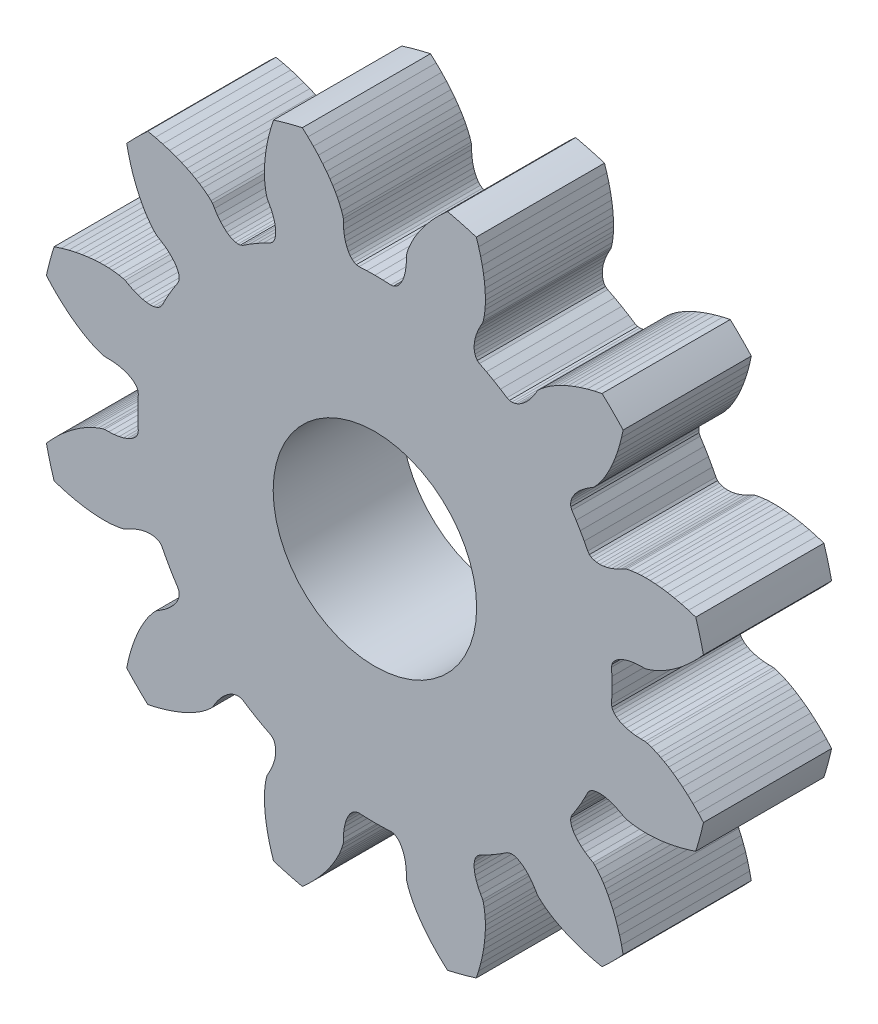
SolidWorks part; units mm, degrees
ref_plane "Piano frontale" through (0, 0, 0) normal (0, 0, 1) x (1, 0, 0)
ref_plane "Piano superiore" through (0, 0, 0) normal (0, 1, 0) x (1, 0, 0)
ref_plane "Piano destro" through (0, 0, 0) normal (1, 0, 0) x (0, 0, -1)
sketch "Model" plane through (0, 0, 0) normal (0, 0, 1) x (1, 0, 0)
  line L0 (76.3044, -6.8551) -> (76.3647, -6.624)
  line L1 (76.3647, -6.624) -> (76.4306, -6.4091)
  line L2 (76.4306, -6.4091) -> (76.5001, -6.2121)
  line L3 (76.5001, -6.2121) -> (76.5724, -6.0314)
  line L4 (76.5724, -6.0314) -> (76.6463, -5.8673)
  line L5 (76.6463, -5.8673) -> (76.7205, -5.7192)
  line L6 (76.7205, -5.7192) -> (76.7938, -5.5872)
  line L7 (76.7938, -5.5872) -> (76.864, -5.4724)
  line L8 (76.864, -5.4724) -> (76.9315, -5.3716)
  line L9 (76.9315, -5.3716) -> (77.051, -5.215)
  line L10 (77.051, -5.215) -> (77.1422, -5.114)
  line L11 (77.1422, -5.114) -> (77.1889, -5.0694)
  line L12 (77.1889, -5.0694) -> (77.3003, -5.0041)
  line L13 (77.3003, -5.0041) -> (77.4412, -4.9107)
  line L14 (77.4412, -4.9107) -> (77.5627, -4.8149)
  line L15 (77.5627, -4.8149) -> (77.6648, -4.7183)
  line L16 (77.6648, -4.7183) -> (77.7477, -4.6221)
  line L17 (77.7477, -4.6221) -> (77.8116, -4.5279)
  line L18 (77.8116, -4.5279) -> (77.8569, -4.4371)
  line L19 (77.8569, -4.4371) -> (77.8841, -4.351)
  line L20 (77.8841, -4.351) -> (77.8935, -4.2711)
  line L21 (77.8935, -4.2711) -> (77.8858, -4.1986)
  line L22 (77.8858, -4.1986) -> (77.8531, -4.1203)
  line L23 (77.8531, -4.1203) -> (77.7211, -3.916)
  line L24 (77.7211, -3.916) -> (77.5914, -3.7)
  line L25 (77.5914, -3.7) -> (77.4691, -3.4797)
  line L26 (77.4691, -3.4797) -> (77.3583, -3.2632)
  line L27 (77.3583, -3.2632) -> (77.3068, -3.1958)
  line L28 (77.3068, -3.1958) -> (77.2479, -3.1528)
  line L29 (77.2479, -3.1528) -> (77.1739, -3.121)
  line L30 (77.1739, -3.121) -> (77.0858, -3.1015)
  line L31 (77.0858, -3.1015) -> (76.9845, -3.0953)
  line L32 (76.9845, -3.0953) -> (76.871, -3.1036)
  line L33 (76.871, -3.1036) -> (76.7463, -3.1273)
  line L34 (76.7463, -3.1273) -> (76.6115, -3.1674)
  line L35 (76.6115, -3.1674) -> (76.4678, -3.2247)
  line L36 (76.4678, -3.2247) -> (76.3165, -3.3)
  line L37 (76.3165, -3.3) -> (76.2042, -3.3639)
  line L38 (76.2042, -3.3639) -> (76.1422, -3.3821)
  line L39 (76.1422, -3.3821) -> (76.0091, -3.4105)
  line L40 (76.0091, -3.4105) -> (75.8138, -3.4357)
  line L41 (75.8138, -3.4357) -> (75.6928, -3.4438)
  line L42 (75.6928, -3.4438) -> (75.5583, -3.4472)
  line L43 (75.5583, -3.4472) -> (75.4073, -3.4446)
  line L44 (75.4073, -3.4446) -> (75.2419, -3.4349)
  line L45 (75.2419, -3.4349) -> (75.0629, -3.4168)
  line L46 (75.0629, -3.4168) -> (74.8702, -3.3891)
  line L47 (74.8702, -3.3891) -> (74.6649, -3.3508)
  line L48 (74.6649, -3.3508) -> (74.4458, -3.3004)
  line L49 (74.4458, -3.3004) -> (74.2155, -3.2371)
  line L50 (74.2155, -3.2371) -> (73.9882, -3.1643)
  line L51 (73.7474, -2.2655) -> (73.9078, -2.0888)
  line L52 (73.9078, -2.0888) -> (74.0756, -1.9189)
  line L53 (74.0756, -1.9189) -> (74.2401, -1.7657)
  line L54 (74.2401, -1.7657) -> (74.3988, -1.6299)
  line L55 (74.3988, -1.6299) -> (74.5519, -1.5095)
  line L56 (74.5519, -1.5095) -> (74.6979, -1.4043)
  line L57 (74.6979, -1.4043) -> (74.8362, -1.3132)
  line L58 (74.8362, -1.3132) -> (74.9657, -1.2355)
  line L59 (74.9657, -1.2355) -> (75.0838, -1.1712)
  line L60 (75.0838, -1.1712) -> (75.1927, -1.1177)
  line L61 (75.1927, -1.1177) -> (75.3744, -1.0418)
  line L62 (75.3744, -1.0418) -> (75.5039, -0.9999)
  line L63 (75.5039, -0.9999) -> (75.5667, -0.9846)
  line L64 (75.5667, -0.9846) -> (75.6959, -0.9838)
  line L65 (75.6959, -0.9838) -> (75.8646, -0.9734)
  line L66 (75.8646, -0.9734) -> (76.0177, -0.9512)
  line L67 (76.0177, -0.9512) -> (76.1544, -0.9185)
  line L68 (76.1544, -0.9185) -> (76.2743, -0.8767)
  line L69 (76.2743, -0.8767) -> (76.3768, -0.8271)
  line L70 (76.3768, -0.8271) -> (76.4614, -0.7711)
  line L71 (76.4614, -0.7711) -> (76.5279, -0.7101)
  line L72 (76.5279, -0.7101) -> (76.5761, -0.6456)
  line L73 (76.5761, -0.6456) -> (76.6057, -0.579)
  line L74 (76.6057, -0.579) -> (76.6165, -0.4949)
  line L75 (76.6165, -0.4949) -> (76.6043, -0.2519)
  line L76 (76.6043, -0.2519) -> (76.6, 0)
  line L77 (76.6, 0) -> (76.6043, 0.2519)
  line L78 (76.6043, 0.2519) -> (76.6165, 0.4949)
  line L79 (76.6165, 0.4949) -> (76.6057, 0.579)
  line L80 (76.6057, 0.579) -> (76.5761, 0.6456)
  line L81 (76.5761, 0.6456) -> (76.5279, 0.7101)
  line L82 (76.5279, 0.7101) -> (76.4614, 0.7711)
  line L83 (76.4614, 0.7711) -> (76.3768, 0.8271)
  line L84 (76.3768, 0.8271) -> (76.2743, 0.8767)
  line L85 (76.2743, 0.8767) -> (76.1544, 0.9185)
  line L86 (76.1544, 0.9185) -> (76.0177, 0.9512)
  line L87 (76.0177, 0.9512) -> (75.8646, 0.9734)
  line L88 (75.8646, 0.9734) -> (75.6959, 0.9838)
  line L89 (75.6959, 0.9838) -> (75.5667, 0.9846)
  line L90 (75.5667, 0.9846) -> (75.5039, 0.9999)
  line L91 (75.5039, 0.9999) -> (75.3744, 1.0418)
  line L92 (75.3744, 1.0418) -> (75.1927, 1.1177)
  line L93 (75.1927, 1.1177) -> (75.0838, 1.1712)
  line L94 (75.0838, 1.1712) -> (74.9657, 1.2355)
  line L95 (74.9657, 1.2355) -> (74.8362, 1.3132)
  line L96 (74.8362, 1.3132) -> (74.6979, 1.4043)
  line L97 (74.6979, 1.4043) -> (74.5519, 1.5095)
  line L98 (74.5519, 1.5095) -> (74.3988, 1.6299)
  line L99 (74.3988, 1.6299) -> (74.2401, 1.7657)
  line L100 (74.2401, 1.7657) -> (74.0756, 1.9189)
  line L101 (74.0756, 1.9189) -> (73.9078, 2.0888)
  line L102 (73.9078, 2.0888) -> (73.7474, 2.2655)
  line L103 (73.9882, 3.1643) -> (74.2155, 3.2371)
  line L104 (74.2155, 3.2371) -> (74.4458, 3.3004)
  line L105 (74.4458, 3.3004) -> (74.6649, 3.3508)
  line L106 (74.6649, 3.3508) -> (74.8702, 3.3891)
  line L107 (74.8702, 3.3891) -> (75.0629, 3.4168)
  line L108 (75.0629, 3.4168) -> (75.2419, 3.4349)
  line L109 (75.2419, 3.4349) -> (75.4073, 3.4446)
  line L110 (75.4073, 3.4446) -> (75.5583, 3.4472)
  line L111 (75.5583, 3.4472) -> (75.6928, 3.4438)
  line L112 (75.6928, 3.4438) -> (75.8138, 3.4357)
  line L113 (75.8138, 3.4357) -> (76.0091, 3.4105)
  line L114 (76.0091, 3.4105) -> (76.1422, 3.3821)
  line L115 (76.1422, 3.3821) -> (76.2042, 3.3639)
  line L116 (76.2042, 3.3639) -> (76.3165, 3.3)
  line L117 (76.3165, 3.3) -> (76.4678, 3.2247)
  line L118 (76.4678, 3.2247) -> (76.6115, 3.1674)
  line L119 (76.6115, 3.1674) -> (76.7463, 3.1273)
  line L120 (76.7463, 3.1273) -> (76.871, 3.1036)
  line L121 (76.871, 3.1036) -> (76.9845, 3.0953)
  line L122 (76.9845, 3.0953) -> (77.0858, 3.1015)
  line L123 (77.0858, 3.1015) -> (77.1739, 3.121)
  line L124 (77.1739, 3.121) -> (77.2479, 3.1528)
  line L125 (77.2479, 3.1528) -> (77.3068, 3.1958)
  line L126 (77.3068, 3.1958) -> (77.3583, 3.2632)
  line L127 (77.3583, 3.2632) -> (77.4691, 3.4797)
  line L128 (77.4691, 3.4797) -> (77.5914, 3.7)
  line L129 (77.5914, 3.7) -> (77.7211, 3.916)
  line L130 (77.7211, 3.916) -> (77.8531, 4.1203)
  line L131 (77.8531, 4.1203) -> (77.8858, 4.1986)
  line L132 (77.8858, 4.1986) -> (77.8935, 4.2711)
  line L133 (77.8935, 4.2711) -> (77.8841, 4.351)
  line L134 (77.8841, 4.351) -> (77.8569, 4.4371)
  line L135 (77.8569, 4.4371) -> (77.8116, 4.5279)
  line L136 (77.8116, 4.5279) -> (77.7477, 4.6221)
  line L137 (77.7477, 4.6221) -> (77.6648, 4.7183)
  line L138 (77.6648, 4.7183) -> (77.5627, 4.8149)
  line L139 (77.5627, 4.8149) -> (77.4412, 4.9107)
  line L140 (77.4412, 4.9107) -> (77.3003, 5.0041)
  line L141 (77.3003, 5.0041) -> (77.1889, 5.0694)
  line L142 (77.1889, 5.0694) -> (77.1422, 5.114)
  line L143 (77.1422, 5.114) -> (77.051, 5.215)
  line L144 (77.051, 5.215) -> (76.9315, 5.3716)
  line L145 (76.9315, 5.3716) -> (76.864, 5.4724)
  line L146 (76.864, 5.4724) -> (76.7938, 5.5872)
  line L147 (76.7938, 5.5872) -> (76.7205, 5.7192)
  line L148 (76.7205, 5.7192) -> (76.6463, 5.8673)
  line L149 (76.6463, 5.8673) -> (76.5724, 6.0314)
  line L150 (76.5724, 6.0314) -> (76.5001, 6.2121)
  line L151 (76.5001, 6.2121) -> (76.4306, 6.4091)
  line L152 (76.4306, 6.4091) -> (76.3647, 6.624)
  line L153 (76.3647, 6.624) -> (76.3044, 6.8551)
  line L154 (76.3044, 6.8551) -> (76.2537, 7.0883)
  line L155 (76.9117, 7.7463) -> (77.1449, 7.6956)
  line L156 (77.1449, 7.6956) -> (77.376, 7.6353)
  line L157 (77.376, 7.6353) -> (77.5909, 7.5694)
  line L158 (77.5909, 7.5694) -> (77.7879, 7.4999)
  line L159 (77.7879, 7.4999) -> (77.9686, 7.4276)
  line L160 (77.9686, 7.4276) -> (78.1327, 7.3537)
  line L161 (78.1327, 7.3537) -> (78.2808, 7.2795)
  line L162 (78.2808, 7.2795) -> (78.4128, 7.2062)
  line L163 (78.4128, 7.2062) -> (78.5276, 7.136)
  line L164 (78.5276, 7.136) -> (78.6284, 7.0685)
  line L165 (78.6284, 7.0685) -> (78.785, 6.949)
  line L166 (78.785, 6.949) -> (78.886, 6.8578)
  line L167 (78.886, 6.8578) -> (78.9306, 6.8111)
  line L168 (78.9306, 6.8111) -> (78.9959, 6.6997)
  line L169 (78.9959, 6.6997) -> (79.0893, 6.5588)
  line L170 (79.0893, 6.5588) -> (79.1851, 6.4373)
  line L171 (79.1851, 6.4373) -> (79.2817, 6.3352)
  line L172 (79.2817, 6.3352) -> (79.3779, 6.2523)
  line L173 (79.3779, 6.2523) -> (79.4721, 6.1884)
  line L174 (79.4721, 6.1884) -> (79.5629, 6.1431)
  line L175 (79.5629, 6.1431) -> (79.649, 6.1159)
  line L176 (79.649, 6.1159) -> (79.7289, 6.1065)
  line L177 (79.7289, 6.1065) -> (79.8014, 6.1142)
  line L178 (79.8014, 6.1142) -> (79.8797, 6.1469)
  line L179 (79.8797, 6.1469) -> (80.084, 6.2789)
  line L180 (80.084, 6.2789) -> (80.3, 6.4086)
  line L181 (80.3, 6.4086) -> (80.5203, 6.5309)
  line L182 (80.5203, 6.5309) -> (80.7368, 6.6417)
  line L183 (80.7368, 6.6417) -> (80.8042, 6.6932)
  line L184 (80.8042, 6.6932) -> (80.8472, 6.7521)
  line L185 (80.8472, 6.7521) -> (80.879, 6.8261)
  line L186 (80.879, 6.8261) -> (80.8985, 6.9142)
  line L187 (80.8985, 6.9142) -> (80.9047, 7.0155)
  line L188 (80.9047, 7.0155) -> (80.8964, 7.129)
  line L189 (80.8964, 7.129) -> (80.8727, 7.2537)
  line L190 (80.8727, 7.2537) -> (80.8326, 7.3885)
  line L191 (80.8326, 7.3885) -> (80.7753, 7.5322)
  line L192 (80.7753, 7.5322) -> (80.7, 7.6835)
  line L193 (80.7, 7.6835) -> (80.6361, 7.7958)
  line L194 (80.6361, 7.7958) -> (80.6179, 7.8578)
  line L195 (80.6179, 7.8578) -> (80.5895, 7.9909)
  line L196 (80.5895, 7.9909) -> (80.5643, 8.1862)
  line L197 (80.5643, 8.1862) -> (80.5562, 8.3072)
  line L198 (80.5562, 8.3072) -> (80.5528, 8.4417)
  line L199 (80.5528, 8.4417) -> (80.5554, 8.5927)
  line L200 (80.5554, 8.5927) -> (80.5651, 8.7581)
  line L201 (80.5651, 8.7581) -> (80.5832, 8.9371)
  line L202 (80.5832, 8.9371) -> (80.6109, 9.1298)
  line L203 (80.6109, 9.1298) -> (80.6492, 9.3351)
  line L204 (80.6492, 9.3351) -> (80.6996, 9.5542)
  line L205 (80.6996, 9.5542) -> (80.7629, 9.7845)
  line L206 (80.7629, 9.7845) -> (80.8357, 10.0118)
  line L207 (81.7345, 10.2526) -> (81.9112, 10.0922)
  line L208 (81.9112, 10.0922) -> (82.0811, 9.9244)
  line L209 (82.0811, 9.9244) -> (82.2343, 9.7599)
  line L210 (82.2343, 9.7599) -> (82.3701, 9.6012)
  line L211 (82.3701, 9.6012) -> (82.4905, 9.4481)
  line L212 (82.4905, 9.4481) -> (82.5957, 9.3021)
  line L213 (82.5957, 9.3021) -> (82.6868, 9.1638)
  line L214 (82.6868, 9.1638) -> (82.7645, 9.0343)
  line L215 (82.7645, 9.0343) -> (82.8288, 8.9162)
  line L216 (82.8288, 8.9162) -> (82.8823, 8.8073)
  line L217 (82.8823, 8.8073) -> (82.9582, 8.6256)
  line L218 (82.9582, 8.6256) -> (83.0001, 8.4961)
  line L219 (83.0001, 8.4961) -> (83.0154, 8.4333)
  line L220 (83.0154, 8.4333) -> (83.0162, 8.3041)
  line L221 (83.0162, 8.3041) -> (83.0266, 8.1354)
  line L222 (83.0266, 8.1354) -> (83.0488, 7.9823)
  line L223 (83.0488, 7.9823) -> (83.0815, 7.8456)
  line L224 (83.0815, 7.8456) -> (83.1233, 7.7257)
  line L225 (83.1233, 7.7257) -> (83.1729, 7.6232)
  line L226 (83.1729, 7.6232) -> (83.2289, 7.5386)
  line L227 (83.2289, 7.5386) -> (83.2899, 7.4721)
  line L228 (83.2899, 7.4721) -> (83.3544, 7.4239)
  line L229 (83.3544, 7.4239) -> (83.421, 7.3943)
  line L230 (83.421, 7.3943) -> (83.5052, 7.3835)
  line L231 (83.5052, 7.3835) -> (83.7481, 7.3957)
  line L232 (83.7481, 7.3957) -> (84, 7.4)
  line L233 (84, 7.4) -> (84.2519, 7.3957)
  line L234 (84.2519, 7.3957) -> (84.4948, 7.3835)
  line L235 (84.4948, 7.3835) -> (84.579, 7.3943)
  line L236 (84.579, 7.3943) -> (84.6456, 7.4239)
  line L237 (84.6456, 7.4239) -> (84.7101, 7.4721)
  line L238 (84.7101, 7.4721) -> (84.7711, 7.5386)
  line L239 (84.7711, 7.5386) -> (84.8271, 7.6232)
  line L240 (84.8271, 7.6232) -> (84.8767, 7.7257)
  line L241 (84.8767, 7.7257) -> (84.9185, 7.8456)
  line L242 (84.9185, 7.8456) -> (84.9512, 7.9823)
  line L243 (84.9512, 7.9823) -> (84.9734, 8.1354)
  line L244 (84.9734, 8.1354) -> (84.9838, 8.3041)
  line L245 (84.9838, 8.3041) -> (84.9846, 8.4333)
  line L246 (84.9846, 8.4333) -> (84.9999, 8.4961)
  line L247 (84.9999, 8.4961) -> (85.0418, 8.6256)
  line L248 (85.0418, 8.6256) -> (85.1177, 8.8073)
  line L249 (85.1177, 8.8073) -> (85.1712, 8.9162)
  line L250 (85.1712, 8.9162) -> (85.2355, 9.0343)
  line L251 (85.2355, 9.0343) -> (85.3132, 9.1638)
  line L252 (85.3132, 9.1638) -> (85.4043, 9.3021)
  line L253 (85.4043, 9.3021) -> (85.5095, 9.4481)
  line L254 (85.5095, 9.4481) -> (85.6299, 9.6012)
  line L255 (85.6299, 9.6012) -> (85.7657, 9.7599)
  line L256 (85.7657, 9.7599) -> (85.9189, 9.9244)
  line L257 (85.9189, 9.9244) -> (86.0888, 10.0922)
  line L258 (86.0888, 10.0922) -> (86.2655, 10.2526)
  line L259 (87.1643, 10.0118) -> (87.2371, 9.7845)
  line L260 (87.2371, 9.7845) -> (87.3004, 9.5542)
  line L261 (87.3004, 9.5542) -> (87.3508, 9.3351)
  line L262 (87.3508, 9.3351) -> (87.3891, 9.1298)
  line L263 (87.3891, 9.1298) -> (87.4168, 8.9371)
  line L264 (87.4168, 8.9371) -> (87.4349, 8.7581)
  line L265 (87.4349, 8.7581) -> (87.4446, 8.5927)
  line L266 (87.4446, 8.5927) -> (87.4472, 8.4417)
  line L267 (87.4472, 8.4417) -> (87.4438, 8.3072)
  line L268 (87.4438, 8.3072) -> (87.4357, 8.1862)
  line L269 (87.4357, 8.1862) -> (87.4105, 7.9909)
  line L270 (87.4105, 7.9909) -> (87.3821, 7.8578)
  line L271 (87.3821, 7.8578) -> (87.3639, 7.7958)
  line L272 (87.3639, 7.7958) -> (87.3, 7.6835)
  line L273 (87.3, 7.6835) -> (87.2247, 7.5322)
  line L274 (87.2247, 7.5322) -> (87.1674, 7.3885)
  line L275 (87.1674, 7.3885) -> (87.1273, 7.2537)
  line L276 (87.1273, 7.2537) -> (87.1036, 7.129)
  line L277 (87.1036, 7.129) -> (87.0953, 7.0155)
  line L278 (87.0953, 7.0155) -> (87.1015, 6.9142)
  line L279 (87.1015, 6.9142) -> (87.121, 6.8261)
  line L280 (87.121, 6.8261) -> (87.1528, 6.7521)
  line L281 (87.1528, 6.7521) -> (87.1958, 6.6932)
  line L282 (87.1958, 6.6932) -> (87.2632, 6.6417)
  line L283 (87.2632, 6.6417) -> (87.4797, 6.5309)
  line L284 (87.4797, 6.5309) -> (87.7, 6.4086)
  line L285 (87.7, 6.4086) -> (87.916, 6.2789)
  line L286 (87.916, 6.2789) -> (88.1203, 6.1469)
  line L287 (88.1203, 6.1469) -> (88.1986, 6.1142)
  line L288 (88.1986, 6.1142) -> (88.2711, 6.1065)
  line L289 (88.2711, 6.1065) -> (88.351, 6.1159)
  line L290 (88.351, 6.1159) -> (88.4371, 6.1431)
  line L291 (88.4371, 6.1431) -> (88.5279, 6.1884)
  line L292 (88.5279, 6.1884) -> (88.6221, 6.2523)
  line L293 (88.6221, 6.2523) -> (88.7183, 6.3352)
  line L294 (88.7183, 6.3352) -> (88.8149, 6.4373)
  line L295 (88.8149, 6.4373) -> (88.9107, 6.5588)
  line L296 (88.9107, 6.5588) -> (89.0041, 6.6997)
  line L297 (89.0041, 6.6997) -> (89.0694, 6.8111)
  line L298 (89.0694, 6.8111) -> (89.114, 6.8578)
  line L299 (89.114, 6.8578) -> (89.215, 6.949)
  line L300 (89.215, 6.949) -> (89.3716, 7.0685)
  line L301 (89.3716, 7.0685) -> (89.4724, 7.136)
  line L302 (89.4724, 7.136) -> (89.5872, 7.2062)
  line L303 (89.5872, 7.2062) -> (89.7192, 7.2795)
  line L304 (89.7192, 7.2795) -> (89.8673, 7.3537)
  line L305 (89.8673, 7.3537) -> (90.0314, 7.4276)
  line L306 (90.0314, 7.4276) -> (90.2121, 7.4999)
  line L307 (90.2121, 7.4999) -> (90.4091, 7.5694)
  line L308 (90.4091, 7.5694) -> (90.624, 7.6353)
  line L309 (90.624, 7.6353) -> (90.8551, 7.6956)
  line L310 (90.8551, 7.6956) -> (91.0883, 7.7463)
  line L311 (91.7463, 7.0883) -> (91.6956, 6.8551)
  line L312 (91.6956, 6.8551) -> (91.6353, 6.624)
  line L313 (91.6353, 6.624) -> (91.5694, 6.4091)
  line L314 (91.5694, 6.4091) -> (91.4999, 6.2121)
  line L315 (91.4999, 6.2121) -> (91.4276, 6.0314)
  line L316 (91.4276, 6.0314) -> (91.3537, 5.8673)
  line L317 (91.3537, 5.8673) -> (91.2795, 5.7192)
  line L318 (91.2795, 5.7192) -> (91.2062, 5.5872)
  line L319 (91.2062, 5.5872) -> (91.136, 5.4724)
  line L320 (91.136, 5.4724) -> (91.0685, 5.3716)
  line L321 (91.0685, 5.3716) -> (90.949, 5.215)
  line L322 (90.949, 5.215) -> (90.8578, 5.114)
  line L323 (90.8578, 5.114) -> (90.8111, 5.0694)
  line L324 (90.8111, 5.0694) -> (90.6997, 5.0041)
  line L325 (90.6997, 5.0041) -> (90.5588, 4.9107)
  line L326 (90.5588, 4.9107) -> (90.4373, 4.8149)
  line L327 (90.4373, 4.8149) -> (90.3352, 4.7183)
  line L328 (90.3352, 4.7183) -> (90.2523, 4.6221)
  line L329 (90.2523, 4.6221) -> (90.1884, 4.5279)
  line L330 (90.1884, 4.5279) -> (90.1431, 4.4371)
  line L331 (90.1431, 4.4371) -> (90.1159, 4.351)
  line L332 (90.1159, 4.351) -> (90.1065, 4.2711)
  line L333 (90.1065, 4.2711) -> (90.1142, 4.1986)
  line L334 (90.1142, 4.1986) -> (90.1469, 4.1203)
  line L335 (90.1469, 4.1203) -> (90.2789, 3.916)
  line L336 (90.2789, 3.916) -> (90.4086, 3.7)
  line L337 (90.4086, 3.7) -> (90.5309, 3.4797)
  line L338 (90.5309, 3.4797) -> (90.6417, 3.2632)
  line L339 (90.6417, 3.2632) -> (90.6932, 3.1958)
  line L340 (90.6932, 3.1958) -> (90.7521, 3.1528)
  line L341 (90.7521, 3.1528) -> (90.8261, 3.121)
  line L342 (90.8261, 3.121) -> (90.9142, 3.1015)
  line L343 (90.9142, 3.1015) -> (91.0155, 3.0953)
  line L344 (91.0155, 3.0953) -> (91.129, 3.1036)
  line L345 (91.129, 3.1036) -> (91.2537, 3.1273)
  line L346 (91.2537, 3.1273) -> (91.3885, 3.1674)
  line L347 (91.3885, 3.1674) -> (91.5322, 3.2247)
  line L348 (91.5322, 3.2247) -> (91.6835, 3.3)
  line L349 (91.6835, 3.3) -> (91.7958, 3.3639)
  line L350 (91.7958, 3.3639) -> (91.8578, 3.3821)
  line L351 (91.8578, 3.3821) -> (91.9909, 3.4105)
  line L352 (91.9909, 3.4105) -> (92.1862, 3.4357)
  line L353 (92.1862, 3.4357) -> (92.3072, 3.4438)
  line L354 (92.3072, 3.4438) -> (92.4417, 3.4472)
  line L355 (92.4417, 3.4472) -> (92.5927, 3.4446)
  line L356 (92.5927, 3.4446) -> (92.7581, 3.4349)
  line L357 (92.7581, 3.4349) -> (92.9371, 3.4168)
  line L358 (92.9371, 3.4168) -> (93.1298, 3.3891)
  line L359 (93.1298, 3.3891) -> (93.3351, 3.3508)
  line L360 (93.3351, 3.3508) -> (93.5542, 3.3004)
  line L361 (93.5542, 3.3004) -> (93.7845, 3.2371)
  line L362 (93.7845, 3.2371) -> (94.0118, 3.1643)
  line L363 (94.2526, 2.2655) -> (94.0922, 2.0888)
  line L364 (94.0922, 2.0888) -> (93.9244, 1.9189)
  line L365 (93.9244, 1.9189) -> (93.7599, 1.7657)
  line L366 (93.7599, 1.7657) -> (93.6012, 1.6299)
  line L367 (93.6012, 1.6299) -> (93.4481, 1.5095)
  line L368 (93.4481, 1.5095) -> (93.3021, 1.4043)
  line L369 (93.3021, 1.4043) -> (93.1638, 1.3132)
  line L370 (93.1638, 1.3132) -> (93.0343, 1.2355)
  line L371 (93.0343, 1.2355) -> (92.9162, 1.1712)
  line L372 (92.9162, 1.1712) -> (92.8073, 1.1177)
  line L373 (92.8073, 1.1177) -> (92.6256, 1.0418)
  line L374 (92.6256, 1.0418) -> (92.4961, 0.9999)
  line L375 (92.4961, 0.9999) -> (92.4333, 0.9846)
  line L376 (92.4333, 0.9846) -> (92.3041, 0.9838)
  line L377 (92.3041, 0.9838) -> (92.1354, 0.9734)
  line L378 (92.1354, 0.9734) -> (91.9823, 0.9512)
  line L379 (91.9823, 0.9512) -> (91.8456, 0.9185)
  line L380 (91.8456, 0.9185) -> (91.7257, 0.8767)
  line L381 (91.7257, 0.8767) -> (91.6232, 0.8271)
  line L382 (91.6232, 0.8271) -> (91.5386, 0.7711)
  line L383 (91.5386, 0.7711) -> (91.4721, 0.7101)
  line L384 (91.4721, 0.7101) -> (91.4239, 0.6456)
  line L385 (91.4239, 0.6456) -> (91.3943, 0.579)
  line L386 (91.3943, 0.579) -> (91.3835, 0.4949)
  line L387 (91.3835, 0.4949) -> (91.3957, 0.2519)
  line L388 (91.3957, 0.2519) -> (91.4, 0)
  line L389 (91.4, 0) -> (91.3957, -0.2519)
  line L390 (91.3957, -0.2519) -> (91.3835, -0.4949)
  line L391 (91.3835, -0.4949) -> (91.3943, -0.579)
  line L392 (91.3943, -0.579) -> (91.4239, -0.6456)
  line L393 (91.4239, -0.6456) -> (91.4721, -0.7101)
  line L394 (91.4721, -0.7101) -> (91.5386, -0.7711)
  line L395 (91.5386, -0.7711) -> (91.6232, -0.8271)
  line L396 (91.6232, -0.8271) -> (91.7257, -0.8767)
  line L397 (91.7257, -0.8767) -> (91.8456, -0.9185)
  line L398 (91.8456, -0.9185) -> (91.9823, -0.9512)
  line L399 (91.9823, -0.9512) -> (92.1354, -0.9734)
  line L400 (92.1354, -0.9734) -> (92.3041, -0.9838)
  line L401 (92.3041, -0.9838) -> (92.4333, -0.9846)
  line L402 (92.4333, -0.9846) -> (92.4961, -0.9999)
  line L403 (92.4961, -0.9999) -> (92.6256, -1.0418)
  line L404 (92.6256, -1.0418) -> (92.8073, -1.1177)
  line L405 (92.8073, -1.1177) -> (92.9162, -1.1712)
  line L406 (92.9162, -1.1712) -> (93.0343, -1.2355)
  line L407 (93.0343, -1.2355) -> (93.1638, -1.3132)
  line L408 (93.1638, -1.3132) -> (93.3021, -1.4043)
  line L409 (93.3021, -1.4043) -> (93.4481, -1.5095)
  line L410 (93.4481, -1.5095) -> (93.6012, -1.6299)
  line L411 (93.6012, -1.6299) -> (93.7599, -1.7657)
  line L412 (93.7599, -1.7657) -> (93.9244, -1.9189)
  line L413 (93.9244, -1.9189) -> (94.0922, -2.0888)
  line L414 (94.0922, -2.0888) -> (94.2526, -2.2655)
  line L415 (94.0118, -3.1643) -> (93.7845, -3.2371)
  line L416 (93.7845, -3.2371) -> (93.5542, -3.3004)
  line L417 (93.5542, -3.3004) -> (93.3351, -3.3508)
  line L418 (93.3351, -3.3508) -> (93.1298, -3.3891)
  line L419 (93.1298, -3.3891) -> (92.9371, -3.4168)
  line L420 (92.9371, -3.4168) -> (92.7581, -3.4349)
  line L421 (92.7581, -3.4349) -> (92.5927, -3.4446)
  line L422 (92.5927, -3.4446) -> (92.4417, -3.4472)
  line L423 (92.4417, -3.4472) -> (92.3072, -3.4438)
  line L424 (92.3072, -3.4438) -> (92.1862, -3.4357)
  line L425 (92.1862, -3.4357) -> (91.9909, -3.4105)
  line L426 (91.9909, -3.4105) -> (91.8578, -3.3821)
  line L427 (91.8578, -3.3821) -> (91.7958, -3.3639)
  line L428 (91.7958, -3.3639) -> (91.6835, -3.3)
  line L429 (91.6835, -3.3) -> (91.5322, -3.2247)
  line L430 (91.5322, -3.2247) -> (91.3885, -3.1674)
  line L431 (91.3885, -3.1674) -> (91.2537, -3.1273)
  line L432 (91.2537, -3.1273) -> (91.129, -3.1036)
  line L433 (91.129, -3.1036) -> (91.0155, -3.0953)
  line L434 (91.0155, -3.0953) -> (90.9142, -3.1015)
  line L435 (90.9142, -3.1015) -> (90.8261, -3.121)
  line L436 (90.8261, -3.121) -> (90.7521, -3.1528)
  line L437 (90.7521, -3.1528) -> (90.6932, -3.1958)
  line L438 (90.6932, -3.1958) -> (90.6417, -3.2632)
  line L439 (90.6417, -3.2632) -> (90.5309, -3.4797)
  line L440 (90.5309, -3.4797) -> (90.4086, -3.7)
  line L441 (90.4086, -3.7) -> (90.2789, -3.916)
  line L442 (90.2789, -3.916) -> (90.1469, -4.1203)
  line L443 (90.1469, -4.1203) -> (90.1142, -4.1986)
  line L444 (90.1142, -4.1986) -> (90.1065, -4.2711)
  line L445 (90.1065, -4.2711) -> (90.1159, -4.351)
  line L446 (90.1159, -4.351) -> (90.1431, -4.4371)
  line L447 (90.1431, -4.4371) -> (90.1884, -4.5279)
  line L448 (90.1884, -4.5279) -> (90.2523, -4.6221)
  line L449 (90.2523, -4.6221) -> (90.3352, -4.7183)
  line L450 (90.3352, -4.7183) -> (90.4373, -4.8149)
  line L451 (90.4373, -4.8149) -> (90.5588, -4.9107)
  line L452 (90.5588, -4.9107) -> (90.6997, -5.0041)
  line L453 (90.6997, -5.0041) -> (90.8111, -5.0694)
  line L454 (90.8111, -5.0694) -> (90.8578, -5.114)
  line L455 (90.8578, -5.114) -> (90.949, -5.215)
  line L456 (90.949, -5.215) -> (91.0685, -5.3716)
  line L457 (91.0685, -5.3716) -> (91.136, -5.4724)
  line L458 (91.136, -5.4724) -> (91.2062, -5.5872)
  line L459 (91.2062, -5.5872) -> (91.2795, -5.7192)
  line L460 (91.2795, -5.7192) -> (91.3537, -5.8673)
  line L461 (91.3537, -5.8673) -> (91.4276, -6.0314)
  line L462 (91.4276, -6.0314) -> (91.4999, -6.2121)
  line L463 (91.4999, -6.2121) -> (91.5694, -6.4091)
  line L464 (91.5694, -6.4091) -> (91.6353, -6.624)
  line L465 (91.6353, -6.624) -> (91.6956, -6.8551)
  line L466 (91.6956, -6.8551) -> (91.7463, -7.0883)
  line L467 (91.0883, -7.7463) -> (90.8551, -7.6956)
  line L468 (90.8551, -7.6956) -> (90.624, -7.6353)
  line L469 (90.624, -7.6353) -> (90.4091, -7.5694)
  line L470 (90.4091, -7.5694) -> (90.2121, -7.4999)
  line L471 (90.2121, -7.4999) -> (90.0314, -7.4276)
  line L472 (90.0314, -7.4276) -> (89.8673, -7.3537)
  line L473 (89.8673, -7.3537) -> (89.7192, -7.2795)
  line L474 (89.7192, -7.2795) -> (89.5872, -7.2062)
  line L475 (89.5872, -7.2062) -> (89.4724, -7.136)
  line L476 (89.4724, -7.136) -> (89.3716, -7.0685)
  line L477 (89.3716, -7.0685) -> (89.215, -6.949)
  line L478 (89.215, -6.949) -> (89.114, -6.8578)
  line L479 (89.114, -6.8578) -> (89.0694, -6.8111)
  line L480 (89.0694, -6.8111) -> (89.0041, -6.6997)
  line L481 (89.0041, -6.6997) -> (88.9107, -6.5588)
  line L482 (88.9107, -6.5588) -> (88.8149, -6.4373)
  line L483 (88.8149, -6.4373) -> (88.7183, -6.3352)
  line L484 (88.7183, -6.3352) -> (88.6221, -6.2523)
  line L485 (88.6221, -6.2523) -> (88.5279, -6.1884)
  line L486 (88.5279, -6.1884) -> (88.4371, -6.1431)
  line L487 (88.4371, -6.1431) -> (88.351, -6.1159)
  line L488 (88.351, -6.1159) -> (88.2711, -6.1065)
  line L489 (88.2711, -6.1065) -> (88.1986, -6.1142)
  line L490 (88.1986, -6.1142) -> (88.1203, -6.1469)
  line L491 (88.1203, -6.1469) -> (87.916, -6.2789)
  line L492 (87.916, -6.2789) -> (87.7, -6.4086)
  line L493 (87.7, -6.4086) -> (87.4797, -6.5309)
  line L494 (87.4797, -6.5309) -> (87.2632, -6.6417)
  line L495 (87.2632, -6.6417) -> (87.1958, -6.6932)
  line L496 (87.1958, -6.6932) -> (87.1528, -6.7521)
  line L497 (87.1528, -6.7521) -> (87.121, -6.8261)
  line L498 (87.121, -6.8261) -> (87.1015, -6.9142)
  line L499 (87.1015, -6.9142) -> (87.0953, -7.0155)
  line L500 (87.0953, -7.0155) -> (87.1036, -7.129)
  line L501 (87.1036, -7.129) -> (87.1273, -7.2537)
  line L502 (87.1273, -7.2537) -> (87.1674, -7.3885)
  line L503 (87.1674, -7.3885) -> (87.2247, -7.5322)
  line L504 (87.2247, -7.5322) -> (87.3, -7.6835)
  line L505 (87.3, -7.6835) -> (87.3639, -7.7958)
  line L506 (87.3639, -7.7958) -> (87.3821, -7.8578)
  line L507 (87.3821, -7.8578) -> (87.4105, -7.9909)
  line L508 (87.4105, -7.9909) -> (87.4357, -8.1862)
  line L509 (87.4357, -8.1862) -> (87.4438, -8.3072)
  line L510 (87.4438, -8.3072) -> (87.4472, -8.4417)
  line L511 (87.4472, -8.4417) -> (87.4446, -8.5927)
  line L512 (87.4446, -8.5927) -> (87.4349, -8.7581)
  line L513 (87.4349, -8.7581) -> (87.4168, -8.9371)
  line L514 (87.4168, -8.9371) -> (87.3891, -9.1298)
  line L515 (87.3891, -9.1298) -> (87.3508, -9.3351)
  line L516 (87.3508, -9.3351) -> (87.3004, -9.5542)
  line L517 (87.3004, -9.5542) -> (87.2371, -9.7845)
  line L518 (87.2371, -9.7845) -> (87.1643, -10.0118)
  line L519 (86.2655, -10.2526) -> (86.0888, -10.0922)
  line L520 (86.0888, -10.0922) -> (85.9189, -9.9244)
  line L521 (85.9189, -9.9244) -> (85.7657, -9.7599)
  line L522 (85.7657, -9.7599) -> (85.6299, -9.6012)
  line L523 (85.6299, -9.6012) -> (85.5095, -9.4481)
  line L524 (85.5095, -9.4481) -> (85.4043, -9.3021)
  line L525 (85.4043, -9.3021) -> (85.3132, -9.1638)
  line L526 (85.3132, -9.1638) -> (85.2355, -9.0343)
  line L527 (85.2355, -9.0343) -> (85.1712, -8.9162)
  line L528 (85.1712, -8.9162) -> (85.1177, -8.8073)
  line L529 (85.1177, -8.8073) -> (85.0418, -8.6256)
  line L530 (85.0418, -8.6256) -> (84.9999, -8.4961)
  line L531 (84.9999, -8.4961) -> (84.9846, -8.4333)
  line L532 (84.9846, -8.4333) -> (84.9838, -8.3041)
  line L533 (84.9838, -8.3041) -> (84.9734, -8.1354)
  line L534 (84.9734, -8.1354) -> (84.9512, -7.9823)
  line L535 (84.9512, -7.9823) -> (84.9185, -7.8456)
  line L536 (84.9185, -7.8456) -> (84.8767, -7.7257)
  line L537 (84.8767, -7.7257) -> (84.8271, -7.6232)
  line L538 (84.8271, -7.6232) -> (84.7711, -7.5386)
  line L539 (84.7711, -7.5386) -> (84.7101, -7.4721)
  line L540 (84.7101, -7.4721) -> (84.6456, -7.4239)
  line L541 (84.6456, -7.4239) -> (84.579, -7.3943)
  line L542 (84.579, -7.3943) -> (84.4948, -7.3835)
  line L543 (84.4948, -7.3835) -> (84.2519, -7.3957)
  line L544 (84.2519, -7.3957) -> (84, -7.4)
  line L545 (84, -7.4) -> (83.7481, -7.3957)
  line L546 (83.7481, -7.3957) -> (83.5052, -7.3835)
  line L547 (83.5052, -7.3835) -> (83.421, -7.3943)
  line L548 (83.421, -7.3943) -> (83.3544, -7.4239)
  line L549 (83.3544, -7.4239) -> (83.2899, -7.4721)
  line L550 (83.2899, -7.4721) -> (83.2289, -7.5386)
  line L551 (83.2289, -7.5386) -> (83.1729, -7.6232)
  line L552 (83.1729, -7.6232) -> (83.1233, -7.7257)
  line L553 (83.1233, -7.7257) -> (83.0815, -7.8456)
  line L554 (83.0815, -7.8456) -> (83.0488, -7.9823)
  line L555 (83.0488, -7.9823) -> (83.0266, -8.1354)
  line L556 (83.0266, -8.1354) -> (83.0162, -8.3041)
  line L557 (83.0162, -8.3041) -> (83.0154, -8.4333)
  line L558 (83.0154, -8.4333) -> (83.0001, -8.4961)
  line L559 (83.0001, -8.4961) -> (82.9582, -8.6256)
  line L560 (82.9582, -8.6256) -> (82.8823, -8.8073)
  line L561 (82.8823, -8.8073) -> (82.8288, -8.9162)
  line L562 (82.8288, -8.9162) -> (82.7645, -9.0343)
  line L563 (82.7645, -9.0343) -> (82.6868, -9.1638)
  line L564 (82.6868, -9.1638) -> (82.5957, -9.3021)
  line L565 (82.5957, -9.3021) -> (82.4905, -9.4481)
  line L566 (82.4905, -9.4481) -> (82.3701, -9.6012)
  line L567 (82.3701, -9.6012) -> (82.2343, -9.7599)
  line L568 (82.2343, -9.7599) -> (82.0811, -9.9244)
  line L569 (82.0811, -9.9244) -> (81.9112, -10.0922)
  line L570 (81.9112, -10.0922) -> (81.7345, -10.2526)
  line L571 (80.8357, -10.0118) -> (80.7629, -9.7845)
  line L572 (80.7629, -9.7845) -> (80.6996, -9.5542)
  line L573 (80.6996, -9.5542) -> (80.6492, -9.3351)
  line L574 (80.6492, -9.3351) -> (80.6109, -9.1298)
  line L575 (80.6109, -9.1298) -> (80.5832, -8.9371)
  line L576 (80.5832, -8.9371) -> (80.5651, -8.7581)
  line L577 (80.5651, -8.7581) -> (80.5554, -8.5927)
  line L578 (80.5554, -8.5927) -> (80.5528, -8.4417)
  line L579 (80.5528, -8.4417) -> (80.5562, -8.3072)
  line L580 (80.5562, -8.3072) -> (80.5643, -8.1862)
  line L581 (80.5643, -8.1862) -> (80.5895, -7.9909)
  line L582 (80.5895, -7.9909) -> (80.6179, -7.8578)
  line L583 (80.6179, -7.8578) -> (80.6361, -7.7958)
  line L584 (80.6361, -7.7958) -> (80.7, -7.6835)
  line L585 (80.7, -7.6835) -> (80.7753, -7.5322)
  line L586 (80.7753, -7.5322) -> (80.8326, -7.3885)
  line L587 (80.8326, -7.3885) -> (80.8727, -7.2537)
  line L588 (80.8727, -7.2537) -> (80.8964, -7.129)
  line L589 (80.8964, -7.129) -> (80.9047, -7.0155)
  line L590 (80.9047, -7.0155) -> (80.8985, -6.9142)
  line L591 (80.8985, -6.9142) -> (80.879, -6.8261)
  line L592 (80.879, -6.8261) -> (80.8472, -6.7521)
  line L593 (80.8472, -6.7521) -> (80.8042, -6.6932)
  line L594 (80.8042, -6.6932) -> (80.7368, -6.6417)
  line L595 (80.7368, -6.6417) -> (80.5203, -6.5309)
  line L596 (80.5203, -6.5309) -> (80.3, -6.4086)
  line L597 (80.3, -6.4086) -> (80.084, -6.2789)
  line L598 (80.084, -6.2789) -> (79.8797, -6.1469)
  line L599 (79.8797, -6.1469) -> (79.8014, -6.1142)
  line L600 (79.8014, -6.1142) -> (79.7289, -6.1065)
  line L601 (79.7289, -6.1065) -> (79.649, -6.1159)
  line L602 (79.649, -6.1159) -> (79.5629, -6.1431)
  line L603 (79.5629, -6.1431) -> (79.4721, -6.1884)
  line L604 (79.4721, -6.1884) -> (79.3779, -6.2523)
  line L605 (79.3779, -6.2523) -> (79.2817, -6.3352)
  line L606 (79.2817, -6.3352) -> (79.1851, -6.4373)
  line L607 (79.1851, -6.4373) -> (79.0893, -6.5588)
  line L608 (79.0893, -6.5588) -> (78.9959, -6.6997)
  line L609 (78.9959, -6.6997) -> (78.9306, -6.8111)
  line L610 (78.9306, -6.8111) -> (78.886, -6.8578)
  line L611 (78.886, -6.8578) -> (78.785, -6.949)
  line L612 (78.785, -6.949) -> (78.6284, -7.0685)
  line L613 (78.6284, -7.0685) -> (78.5276, -7.136)
  line L614 (78.5276, -7.136) -> (78.4128, -7.2062)
  line L615 (78.4128, -7.2062) -> (78.2808, -7.2795)
  line L616 (78.2808, -7.2795) -> (78.1327, -7.3537)
  line L617 (78.1327, -7.3537) -> (77.9686, -7.4276)
  line L618 (77.9686, -7.4276) -> (77.7879, -7.4999)
  line L619 (77.7879, -7.4999) -> (77.5909, -7.5694)
  line L620 (77.5909, -7.5694) -> (77.376, -7.6353)
  line L621 (77.376, -7.6353) -> (77.1449, -7.6956)
  line L622 (77.1449, -7.6956) -> (76.9117, -7.7463)
  line L623 (76.2537, -7.0883) -> (76.3044, -6.8551)
  circle A0 centre (84, 0) radius 2
  circle A1 centre (84, 0) radius 2
  arc A2 (73.7474, -2.2655) -> (73.9882, -3.1643) centre (84, 0) ccw
  arc A3 (73.9882, 3.1643) -> (73.7474, 2.2655) centre (84, 0) ccw
  arc A4 (76.9117, 7.7463) -> (76.2537, 7.0883) centre (84, 0) ccw
  arc A5 (81.7345, 10.2526) -> (80.8357, 10.0118) centre (84, 0) ccw
  arc A6 (87.1643, 10.0118) -> (86.2655, 10.2526) centre (84, 0) ccw
  arc A7 (91.7463, 7.0883) -> (91.0883, 7.7463) centre (84, 0) ccw
  arc A8 (94.2526, 2.2655) -> (94.0118, 3.1643) centre (84, 0) ccw
  arc A9 (94.0118, -3.1643) -> (94.2526, -2.2655) centre (84, 0) ccw
  arc A10 (91.0883, -7.7463) -> (91.7463, -7.0883) centre (84, 0) ccw
  arc A11 (86.2655, -10.2526) -> (87.1643, -10.0118) centre (84, 0) ccw
  arc A12 (80.8357, -10.0118) -> (81.7345, -10.2526) centre (84, 0) ccw
  arc A13 (76.2537, -7.0883) -> (76.9117, -7.7463) centre (84, 0) ccw
extrude "Estrusione-Estrusione1" add sketch "Model" along normal blind 4 contours L623 A13 L622 L621 L620 L619 L618 L617 L616 L615 L614 L613 L612 L611 L610 L609 L608 L607 L606 L605 L604 L603 L602 L601 L600 L599 L598 L597 L596 L595 L594 L593 L592 L591 L590 L589 L588 L587 L586 L585 L584 L583 L582 L581 L580 L579 L578 L577 L576 L575 L574
sketch "Schizzo2" plane through (0, 0, 0) normal (0, 0, -1) x (-1, 0, 0)
  circle A0 centre (-84, 0) radius 3.175
  dimension "D1" = 6.35
extrude "Taglio-Estrusione1" cut sketch "Schizzo2" against normal through all
